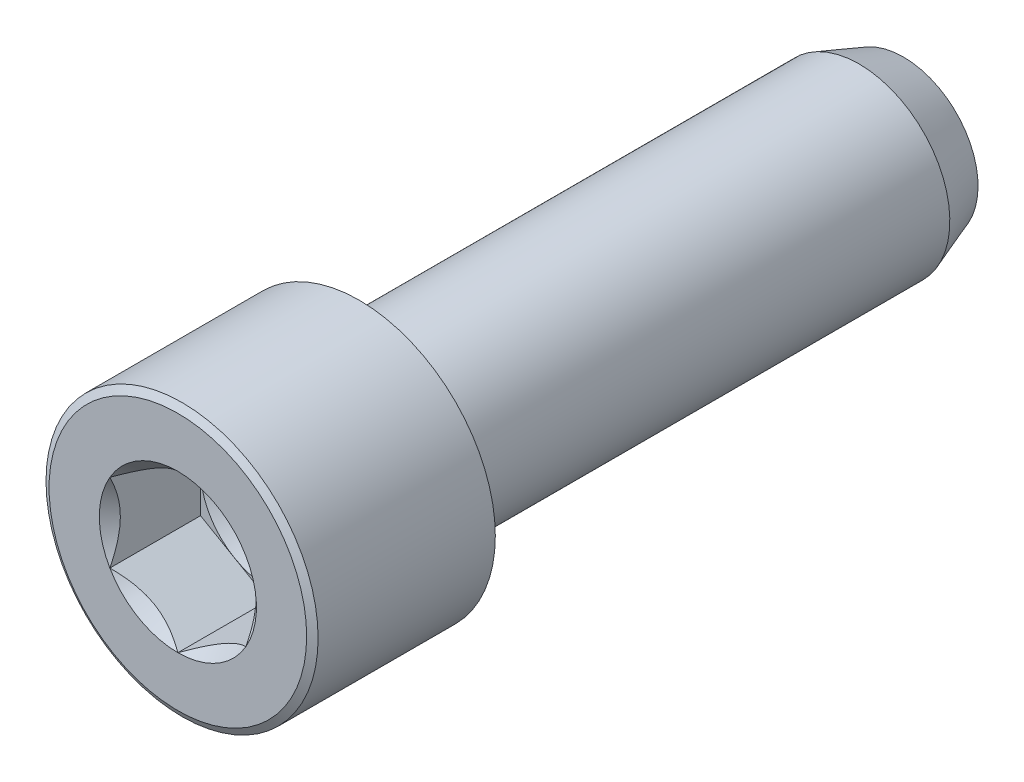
SolidWorks part; units mm, degrees
ref_plane "Front" through (0, 0, 0) normal (0, 0, 1) x (1, 0, 0)
ref_plane "Top" through (0, 0, 0) normal (0, 1, 0) x (1, 0, 0)
ref_plane "Right" through (0, 0, 0) normal (1, 0, 0) x (0, 0, -1)
sketch "Sketch1" plane through (0, 0, 0) normal (1, 0, 0) x (0, 0, -1)
  line L0 (0, 0) -> (-1.905, 0) construction
  line L1 (0, 0) -> (19.05, 0)
  line L2 (0, 0) -> (0, 3.175)
  line L3 (0, 3.175) -> (19.05, 3.175)
  line L4 (19.05, 0) -> (19.05, 3.175)
  line L5 (0, -3.175) -> (19.05, -3.175) construction
revolve "Revolve1" add sketch "Sketch1" angle 360 about L0
sketch "Sketch2" plane through (0, 0, 0) normal (1, 0, 0) x (0, 0, -1)
  line L0 (0, 3.175) -> (0, -3.175) construction
  line L1 (0, -3.175) -> (1.27, -3.175) construction
  line L2 (1.27, -3.175) -> (0, 3.175) construction
  line L3 (0, 3.175) -> (0.1557, 3.2061) construction
  line L4 (0.1557, 3.2061) -> (1.2453, 3.4241)
  line L5 (1.2453, 3.4241) -> (0.991, 2.6722)
  line L6 (0.991, 2.6722) -> (0.6796, 2.6099)
  line L7 (0.6796, 2.6099) -> (0.1557, 3.2061)
  line L8 (0.8353, 2.641) -> (0.7005, 3.3151) construction
  line L9 (0, -3.175) -> (19.05, -3.175) construction
  line L10 (0, 3.175) -> (19.05, 3.175) construction
  line L12 (0.7285, 3.175) -> (1.9985, -3.175) construction
  line L13 (0, -0.2727) -> (2.727, 0.2727) construction
  line L15 (0, 0) -> (0, 3.175) construction
  point P19 (1.3635, 0)
revolve "Cut-Revolve1" [suppressed] cut sketch "Sketch2" angle 360 about L13
sketch "Sketch3" plane through (0, 0, 0) normal (1, 0, 0) x (0, 0, -1)
  line L0 (19.05, 2.6099) -> (17.4974, 3.175)
  line L1 (17.4974, 3.175) -> (19.05, 3.175)
  line L2 (19.05, 3.175) -> (19.05, 2.6099)
  line L3 (0, 3.175) -> (19.05, 3.175) construction
  line L4 (19.05, 0) -> (19.05, 3.175) construction
  line L5 (17.4974, 0) -> (0, 0) construction
  line L6 (17.4974, 3.175) -> (17.4974, -3.175) construction
  line L7 (0, -3.175) -> (19.05, -3.175) construction
  dimension "D1" = 20
  dimension "D2" = 6.35
revolve "Cut-Revolve2" cut sketch "Sketch3" angle 360 about L5
pattern_linear "LPattern1" [suppressed] count 15 spacing 1.27 along (0, 0, 1)
pattern_linear "LPattern2" [suppressed] count 2 spacing 1.27 along (0, 0, 1)
sketch "Sketch4" plane through (0, 0, 0) normal (0, 0, 1) x (1, 0, 0)
  circle A0 centre (0, 0) radius 4.7625
  dimension "Head Dia" = 9.525
extrude "Extrude1" add sketch "Sketch4" along normal blind 6.35
chamfer "Chamfer1" distance 0.254 angle 30 1 edges at (4.7625, 0, 6.35)
sketch "Sketch6" plane through (0, 0, 6.35) normal (0, 0, 1) x (1, 0, 0)
  line L1 (0, -2.7496) -> (2.3812, -1.3748)
  line L2 (2.3812, -1.3748) -> (2.3812, 1.3748)
  line L3 (2.3812, 1.3748) -> (0, 2.7496)
  line L4 (0, 2.7496) -> (-2.3813, 1.3748)
  line L5 (-2.3813, 1.3748) -> (-2.3813, -1.3748)
  line L6 (-2.3813, -1.3748) -> (0, -2.7496)
  circle A0 centre (0, 0) radius 2.3813 construction
  dimension "Hex" = 4.7625
extrude "Cut-Extrude1" cut sketch "Sketch6" against normal blind 3.175
sketch "Sketch7" plane through (0, 0, 6.35) normal (0, 0, 1) x (1, 0, 0)
  circle A0 centre (0, 0) radius 2.7496
extrude "Cut-Extrude4" cut sketch "Sketch7" against normal blind 3.175 draft 45
sketch "Sketch8" plane through (0, 0, 3.175) normal (0, 0, 1) x (1, 0, 0)
  circle A0 centre (0, 0) radius 2.3813 construction
  circle A1 centre (0, 0) radius 2.3813
extrude "Cut-Extrude5" cut sketch "Sketch8" against normal blind 1.0583 draft 60
equation "\"D1@Sketch1\"=\"Screw Length@Sketch1\"/10"
equation "\"D2@Sketch2\"=\"Thread Pitch@Sketch2\"/8"
equation "\"D3@Sketch2\"=\"Thread Pitch@Sketch2\"/4"
equation "\"D4@Sketch2\"=\"Thread Pitch@Sketch2\""
equation "\"D3@LPattern1\"=\"Thread Pitch@Sketch2\""
equation "\"D1@Chamfer1\"=\"Thread Dia@Sketch1\"/25"
equation "\"D1@Cut-Extrude1\"=\"Head Height@Extrude1\"/2"
equation "\"D1@Cut-Extrude4\"=\"D1@Cut-Extrude1\""
equation "\"D1@Cut-Extrude5\"=\"D1@Cut-Extrude1\"/3"
equation "\"D1@LPattern1\"=\"Screw Length@Sketch1\"/\"Thread Pitch@Sketch2\""
equation "\"D3@LPattern2\"=\"Thread Pitch@Sketch2\""
